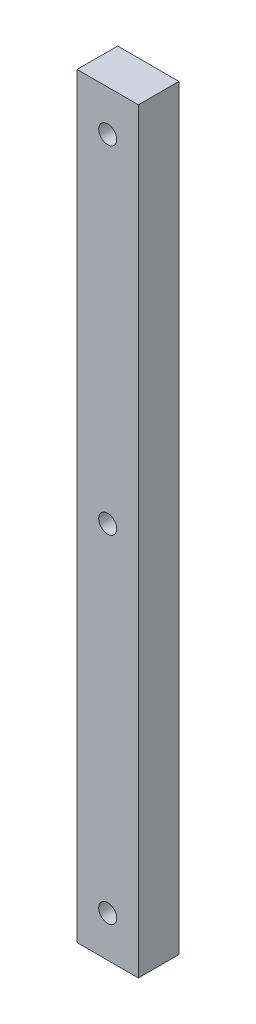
SolidWorks part; units mm, degrees
ref_plane "Front Plane" through (0, 0, 0) normal (0, 0, 1) x (1, 0, 0)
ref_plane "Top Plane" through (0, 0, 0) normal (0, 1, 0) x (1, 0, 0)
ref_plane "Right Plane" through (0, 0, 0) normal (1, 0, 0) x (0, 0, -1)
sketch "Sketch1" plane through (0, 0, 0) normal (0, 0, 1) x (1, 0, 0)
  line L1 (-225.425, 117.475) -> (-206.375, 117.475)
  line L2 (-225.425, 117.475) -> (-225.425, -117.475)
  line L3 (-225.425, -117.475) -> (-206.375, -117.475)
  line L4 (-206.375, 117.475) -> (-206.375, -117.475)
  dimension "D1" = 19.05
extrude "Boss-Extrude1" add sketch "Sketch1" along normal blind 12.5984
hole_wizard "CBORE for #10 Binding Head Machine Screw1" positions "Sketch3" profile "Sketch2" counterbore size "#10" standard "ANSI Inch"
sketch "Sketch3" plane through (0, 0, 0) normal (0, 0, -1) x (-1, 0, 0)
  line L1 (215.9, 123.4951) -> (215.9, -146.9809) construction
  line L3 (225.425, 117.475) -> (225.425, -117.475) construction
  line L4 (206.375, -117.475) -> (206.375, 117.475) construction
  line L5 (285.7501, 0) -> (159.4032, 0) construction
  line L7 (206.375, 117.475) -> (225.425, 117.475) construction
  line L8 (225.425, -117.475) -> (206.375, -117.475) construction
  point P0 (215.9, 0)
sketch "Sketch2" plane through (-215.9, 0, 0) normal (1, 0, 0) x (0, 1, 0)
  line L0 (0, 0) -> (0, 12.5984)
  line L1 (0, 12.5984) -> (2.8067, 12.5984)
  line L3 (2.8067, 12.5984) -> (2.8067, 3.1242)
  line L4 (2.8067, 3.1242) -> (5.5562, 3.1242)
  line L5 (5.5562, 3.1242) -> (5.5562, 0)
  line L7 (5.5562, 0) -> (0, 0)
  line L11 (0, -6.35) -> (0, 107.95) construction
  dimension "Thru Hole Dia." = 5.6134
  dimension "Thru Hole Depth" = 12.5984
  dimension "C'Bore Dia." = 11.1125
  dimension "C'Bore Depth" = 3.1242
hole_wizard "#10 Clearance Hole1" positions "Sketch4" profile "Sketch5" hole size "#10" standard "ANSI Inch"
sketch "Sketch4" plane through (0, 0, 0) normal (0, 0, -1) x (-1, 0, 0)
  line L0 (215.9, 124.1999) -> (215.9, -130.2118) construction
  line L2 (206.375, -117.475) -> (206.375, 117.475) construction
  line L3 (225.425, 117.475) -> (225.425, -117.475) construction
  circle A0 centre (215.9, 0) radius 2.8067 construction
  point P0 (215.9, 104.775)
  point P2 (215.9, -104.775)
  dimension "D2" = 104.775
  dimension "D1" = 104.775
sketch "Sketch5" plane through (-215.9, 104.775, 0) normal (1, 0, 0) x (0, 1, 0)
  line L0 (0, 0) -> (0, 12.5984)
  line L1 (0, 12.5984) -> (2.8067, 12.5984)
  line L2 (2.8067, 12.5984) -> (2.8067, 0)
  line L5 (2.8067, 0) -> (0, 0)
  line L11 (0, -6.35) -> (0, 107.95) construction
  dimension "Thru Hole Dia." = 5.6134
  dimension "Thru Hole Depth" = 12.5984
